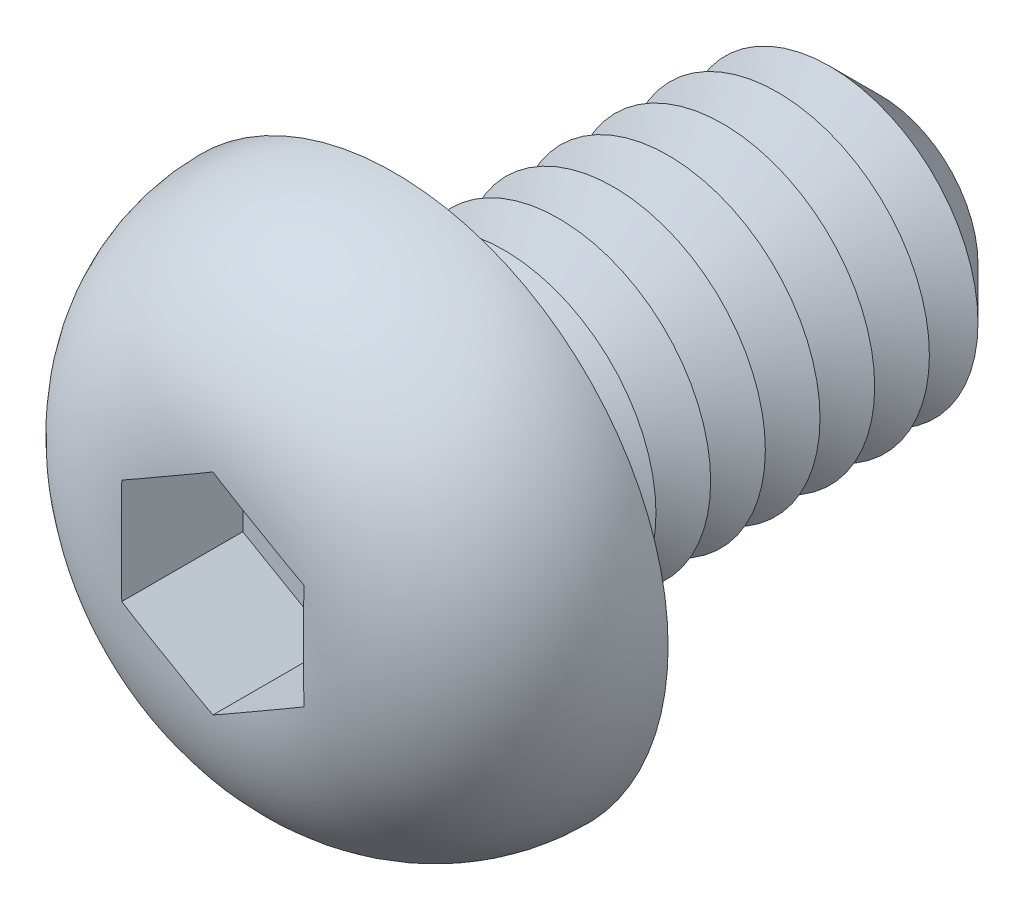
SolidWorks part; units mm, degrees
ref_plane "Front Plane" through (0, 0, 0) normal (0, 0, 1) x (1, 0, 0)
ref_plane "Top Plane" through (0, 0, 0) normal (0, 1, 0) x (1, 0, 0)
ref_plane "Right Plane" through (0, 0, 0) normal (1, 0, 0) x (0, 0, -1)
sketch "Sketch1" plane through (0, 0, 0) normal (1, 0, 0) x (0, 0, -1)
  line L0 (-47.9342, 0) -> (60.3146, 0) construction
sketch "Sketch2" plane through (0, 0, 0) normal (1, 0, 0) x (0, 0, -1)
  line L0 (0, 0) -> (-1.5, 0)
  line L1 (-47.9342, 0) -> (60.3146, 0) construction
  line L2 (-1.5, 0) -> (-1.5, 0.75)
  line L3 (0, 2.25) -> (0, 0)
  arc A0 (-1.5, 0.75) -> (0, 2.25) centre (0, 0.75) cw
  dimension "D1" = 1.5
  dimension "D2" = 1.5
  dimension "D3" = 2.25
revolve "Revolve1" add sketch "Sketch2" angle 360 about L0
sketch "Sketch3" plane through (0, 0, 1.5) normal (0, 0, 1) x (1, 0, 0)
  line L1 (0, 0.866) -> (-0.75, 0.433)
  line L2 (-0.75, 0.433) -> (-0.75, -0.433)
  line L3 (-0.75, -0.433) -> (0, -0.866)
  line L4 (0, -0.866) -> (0.75, -0.433)
  line L5 (0.75, -0.433) -> (0.75, 0.433)
  line L6 (0.75, 0.433) -> (0, 0.866)
  circle A0 centre (0, 0) radius 0.75 construction
  dimension "D1" = 1.5
extrude "Cut-Extrude1" cut sketch "Sketch3" against normal blind 1
sketch "Sketch4" plane through (0, 0, 0) normal (0, 0, -1) x (-1, 0, 0)
  circle A0 centre (0, 0) radius 1.25
  dimension "D1" = 2.5
extrude "Boss-Extrude1" add sketch "Sketch4" along normal blind 4
chamfer "Chamfer1" distance 0.45 angle 45 1 edges at (-1.25, 0, -4)
sketch "Sketch5" plane through (0, 0, 0) normal (1, 0, 0) x (0, 0, -1)
  line L0 (0.45, 1.25) -> (0.9, 1.25)
  line L1 (3.55, 1.25) -> (0, 1.25) construction
  line L2 (0.9, 1.25) -> (0.675, 0.8603)
  line L3 (0.675, 0.8603) -> (0.45, 1.25)
  line L4 (0, -2.25) -> (0, 2.25) construction
  line L5 (3.55, 1.25) -> (0, 1.25) construction
  dimension "D1" = 0.45
  dimension "D2" = 0.45
revolve "Cut-Revolve1" cut sketch "Sketch5" angle 360 about L0
pattern_linear "LPattern1" count 7 spacing 0.45 along (0, 0, -1) of "Cut-Revolve1"
fillet "Fillet2" radius 0.225 1 edges at (1.25, 0, 0)
sketch "Sketch6" plane through (0, 0, 0.5) normal (0, 0, 1) x (1, 0, 0)
  circle A0 centre (0, 0) radius 0.45
  dimension "D1" = 0.9
extrude "Cut-Extrude2" cut sketch "Sketch6" against normal up to surface (4.5 mm away)
